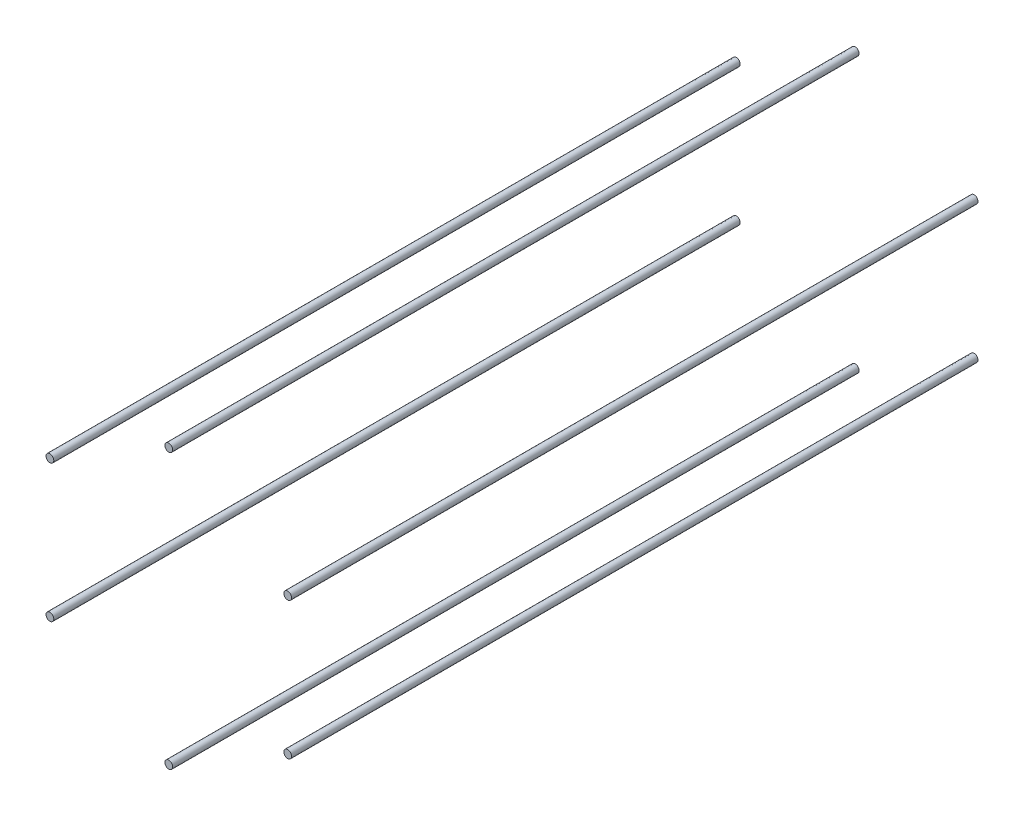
SolidWorks part; units mm, degrees
ref_plane "Front Plane" through (0, 0, 0) normal (1, 0, 0) x (0, 1, 0)
ref_plane "Top Plane" through (0, 0, 0) normal (0, 0, 1) x (0, 1, 0)
ref_plane "Right Plane" through (0, 0, 0) normal (0, 1, 0) x (-1, 0, 0)
sketch "Hex 6in Beam" plane through (0, 0, 0) normal (0, 0, 1) x (0, 1, 0)
  line L1 (115.4305, -199.9315) -> (230.8611, 0)
  line L2 (230.8611, 0) -> (115.4305, 199.9315)
  line L3 (115.4305, 199.9315) -> (-115.4305, 199.9315)
  line L4 (-115.4305, 199.9315) -> (-230.8611, 0)
  line L5 (-230.8611, 0) -> (-115.4305, -199.9315)
  line L6 (-115.4305, -199.9315) -> (115.4305, -199.9315)
  circle A0 centre (0, 0) radius 199.9315 construction
  line B0 (76.2, 76.2) -> (215.5261, 215.5261) construction
  line B1 (-76.2, 76.2) -> (76.2, 76.2) construction
  line B2 (-76.2, 76.2) -> (-76.2, -76.2) construction
  line B3 (-76.2, -76.2) -> (76.2, -76.2) construction
  line B4 (76.2, 76.2) -> (76.2, -76.2) construction
  line B5 (-76.2, 76.2) -> (76.2, -76.2) construction
  line B6 (-76.2, -76.2) -> (76.2, 76.2) construction
  line B7 (238.1934, 0) -> (119.0967, 206.2815)
  line B8 (119.0967, 206.2815) -> (-119.0967, 206.2815)
  line B9 (-119.0967, 206.2815) -> (-238.1934, 0)
  line B10 (-238.1934, 0) -> (-119.0967, -206.2815)
  line B11 (-119.0967, -206.2815) -> (119.0967, -206.2815)
  line B12 (119.0967, -206.2815) -> (238.1934, 0)
  circle B13 centre (0, 0) radius 206.2815 construction
  dimension "D1" = 6.35
sketch_block_instance "Blk 6in Hex-1"
sketch_block "Blk 6in Hex" parameters "D1"=152.4, "D2"=152.4
sketch "Sketch2" plane through (0, 0, 0) normal (0, 0, 1) x (0, 1, 0)
  line L0 (230.8611, 0) -> (115.4305, 199.9315) construction
  circle A0 centre (223.5287, 0) radius 6.35
  circle A1 centre (111.7644, -193.5815) radius 6.35
  circle A2 centre (-111.7644, -193.5815) radius 6.35
  circle A3 centre (-223.5287, 0) radius 6.35
  circle A4 centre (-111.7644, 193.5815) radius 6.35
  circle A5 centre (111.7644, 193.5815) radius 6.35
  point P17 (0, 0)
  dimension "D1" = 12.7
  dimension "D2" = 6
extrude "Boss-Extrude1" add sketch "Sketch2" along normal mid plane 1117.6
